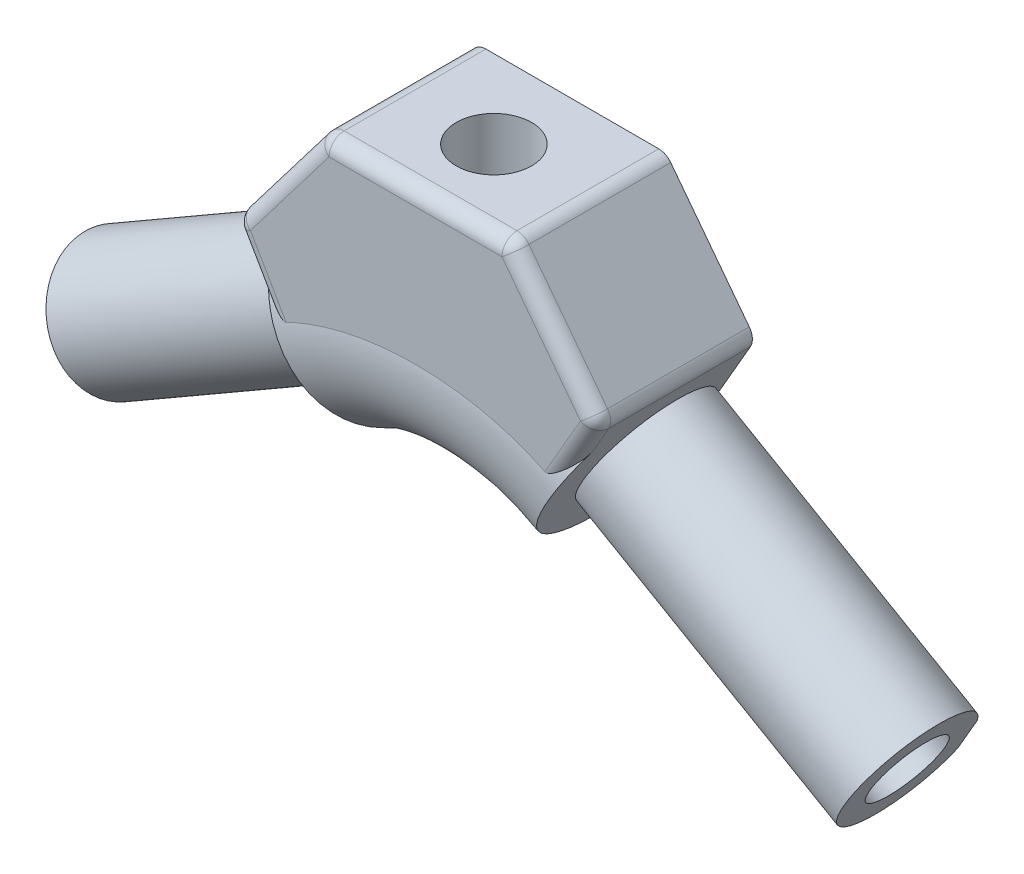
SolidWorks part; units mm, degrees
ref_plane "Płaszczyzna przednia" through (0, 0, 0) normal (0, 0, 1) x (1, 0, 0)
ref_plane "Płaszczyzna górna" through (0, 0, 0) normal (0, 1, 0) x (1, 0, 0)
ref_plane "Płaszczyzna prawa" through (0, 0, 0) normal (1, 0, 0) x (0, 0, -1)
sketch3d "Szkic 3D1"
  circle A2 centre (23.4458, 29.3718, 70.0368) radius 2.25
  circle A3 centre (14.5542, 29.3718, 70.0368) radius 2.25
  point P7 (25.3944, 28.2468, 70.0368)
  point P9 (12.6056, 28.2468, 70.0368)
ref_plane "Płaszczyzna1" through (4.866, -2.8094, 0) normal (0.866, -0.5, 0) x (0, 0, -1)
ref_plane "Płaszczyzna2" through (23.634, 13.6451, 0) normal (-0.866, -0.5, 0) x (0, 0, 1)
sketch "Szkic2" plane through (4.866, -2.8094, 0) normal (0.866, -0.5, 0) x (0, 0, -1)
  circle A0 centre (-70.0368, 37.1596) radius 2.1
  dimension "D1" = 4.2
extrude "Dodanie-wyciągnięcie1" add sketch "Szkic2" along normal blind 10
sketch "Szkic3" plane through (23.634, 13.6451, 0) normal (-0.866, -0.5, 0) x (0, 0, 1)
  circle A0 centre (70.0368, 18.1596) radius 2.1
  dimension "D1" = 4.2
extrude "Dodanie-wyciągnięcie2" add sketch "Szkic3" along normal blind 10 separate body
sketch "Szkic4" plane through (4.866, -2.8094, 0) normal (0.866, -0.5, 0) x (0, 0, -1)
  circle A0 centre (-70.0368, 37.1596) radius 3.25
  dimension "D1" = 6.5
sketch "Szkic5" plane through (23.634, 13.6451, 0) normal (-0.866, -0.5, 0) x (0, 0, 1)
  circle A0 centre (70.0368, 18.1596) radius 3.25
  dimension "D1" = 6.5
loft "Wyciągnięcie po profilach1" add profiles "Szkic5", "Szkic4"
hole_wizard "Otwór gwintowany M31" positions "Szkic6" profile "Szkic7" tap size "M3" standard "DIN"
sketch "Szkic6" plane through (14.9737, 8.6451, 0) normal (-0.866, -0.5, 0) x (0, 0, 1)
  point P0 (70.0368, 18.1596)
sketch "Szkic7" plane through (5.8939, 24.3718, 70.0368) normal (0, 0, 1) x (0.5, -0.866, 0)
  line L0 (0, 0) -> (0, 12)
  line L1 (0, 12) -> (1.25, 11.2489)
  line L2 (1.25, 11.2489) -> (1.25, 0)
  line L5 (1.25, 0) -> (0, 0)
  line L10 (0, 12) -> (-1.25, 11.2489) construction
  line L11 (0, -6.35) -> (0, 107.95) construction
  dimension "Średnica wiertła gwintu" = 2.5
  dimension "Głębokość otworu gwintowanego" = 12
  dimension "Kąt wiertła" = 118
hole_wizard "Otwór gwintowany M32" positions "Szkic8" profile "Szkic9" tap size "M3" standard "DIN"
sketch "Szkic8" plane through (13.5263, -7.8094, 0) normal (0.866, -0.5, 0) x (0, 0, -1)
  point P0 (-70.0368, 37.1596)
sketch "Szkic9" plane through (32.1061, 24.3718, 70.0368) normal (0, 0, 1) x (0.5, 0.866, 0)
  line L0 (0, 0) -> (0, 12)
  line L1 (0, 12) -> (1.25, 11.2489)
  line L2 (1.25, 11.2489) -> (1.25, 0)
  line L5 (1.25, 0) -> (0, 0)
  line L10 (0, 12) -> (-1.25, 11.2489) construction
  line L11 (0, -6.35) -> (0, 107.95) construction
  dimension "Średnica wiertła gwintu" = 2.5
  dimension "Głębokość otworu gwintowanego" = 12
  dimension "Kąt wiertła" = 118
sketch "Szkic10" plane through (4.866, -2.8094, 0) normal (0.866, -0.5, 0) x (0, 0, -1)
  line L1 (-59.4252, 44.0746) -> (-68.0368, 44.0746)
  line L2 (-59.4252, 44.0746) -> (-59.4252, 20.613)
  line L3 (-59.4252, 20.613) -> (-68.0368, 20.613)
  line L4 (-68.0368, 44.0746) -> (-68.0368, 20.613)
  circle A2 centre (-70.0368, 37.1596) radius 2.1 construction
  dimension "D1" = 0.1
extrude "Wytnij-wyciągnięcie1" cut sketch "Szkic10" against normal through all both and the other way through all
sketch "Szkic11" plane through (0, 0, 68.0368) normal (0, 0, -1) x (-1, 0, 0)
  line L1 (-22.1132, 36.0637) -> (-15.8868, 36.0637)
sketch "Szkic12" plane through (0, 0, 68.0368) normal (0, 0, -1) x (-1, 0, 0)
  line L0 (-22.1132, 36.0637) -> (-25.0709, 32.1864)
  line L1 (-25.0709, 32.1864) -> (-24.7267, 31.5902)
  line L2 (-22.1132, 36.0637) -> (-15.8868, 36.0637)
  line L3 (-15.8868, 36.0637) -> (-12.9291, 32.1865)
  line L4 (-12.9291, 32.1865) -> (-13.2734, 31.5902)
  spline S0 degree 3 poles (-962.2729, -2813.1692) (-5.856, -159.0771) (21.6742, 23.5832) (-17.0001, 32.9046) (-17.999, 33.017) (-19.991, 33.0172) (-20.9879, 32.9054) (-22.4418, 32.5564) (-22.9196, 32.4094) (-55.79, 19.6883) (-22.9038, -151.0074) (1024.058, -2777.9621) knots -9.492973 -9.492973 -9.492973 -9.492973 0.25 0.25 0.5 0.5 0.75 0.75 0.875 0.875 9.635108 9.635108 9.635108 9.635108 only from (-13.2734, 31.5902) to (-24.7267, 31.5902) construction
  spline S1 degree 3 poles (-13.2734, 31.5902) (-14.1404, 32.0908) (-15.065, 32.4382) (-17.0001, 32.9046) (-17.999, 33.017) (-19.991, 33.0172) (-20.9879, 32.9054) (-22.4418, 32.5564) (-22.9196, 32.4094) (-23.8444, 32.0515) (-24.2936, 31.8403) (-24.7267, 31.5902) knots 0 0 0 0 0.25 0.25 0.5 0.5 0.75 0.75 0.875 0.875 1 1 1 1
extrude "Dodanie-wyciągnięcie3" add sketch "Szkic12" against normal blind 5.2
sketch "Szkic13" plane through (0, 0, 73.2368) normal (0, 0, 1) x (1, 0, 0)
  line L0 (13.5042, 31.1904) -> (15.6042, 27.5531) construction
  line L1 (22.3958, 27.5531) -> (24.4958, 31.1904) construction
  line L2 (13.2734, 31.5902) -> (14.5542, 29.3718)
  line L3 (23.4458, 29.3718) -> (24.7267, 31.5902)
  line L4 (19, 30.4554) -> (19, 33.0171) construction
  arc A0 (14.5542, 29.3718) -> (23.4458, 29.3718) centre (19, 20.7938) cw
  spline S0 degree 3 poles (-655.4537, -1848.5356) (30.5463, -108.092) (51.4464, 21.3693) (22.9196, 32.4094) (22.4418, 32.5564) (20.9879, 32.9054) (19.991, 33.0172) (17.999, 33.017) (17.0001, 32.9046) (-16.6088, 24.8041) (-0.3634, -113.1332) (625.0206, -1871.7683) knots -7.460999 -7.460999 -7.460999 -7.460999 0.125 0.125 0.25 0.25 0.5 0.5 0.75 0.75 9.184126 9.184126 9.184126 9.184126 only from (24.7267, 31.5902) to (13.2734, 31.5902) construction
  spline S1 degree 3 poles (24.7267, 31.5902) (24.2936, 31.8403) (23.8444, 32.0515) (22.9196, 32.4094) (22.4418, 32.5564) (20.9879, 32.9054) (19.991, 33.0172) (17.999, 33.017) (17.0001, 32.9046) (15.065, 32.4382) (14.1404, 32.0908) (13.2734, 31.5902) knots 0 0 0 0 0.125 0.125 0.25 0.25 0.5 0.5 0.75 0.75 1 1 1 1
  dimension "D1" = 9.6616
extrude "Dodanie-wyciągnięcie4" add sketch "Szkic13" against normal blind 1.3
sketch "Szkic14" plane through (0, 36.0637, 0) normal (0, 1, 0) x (1, 0, 0)
  line L0 (15.8868, -68.0368) -> (22.1132, -73.2368)
  point P4 (19, -70.6368)
hole_wizard "Otwór gwintowany M33" positions "Szkic15" profile "Szkic16" tap size "M3" standard "DIN"
sketch "Szkic15" plane through (0, 36.0637, 0) normal (0, 1, 0) x (1, 0, 0)
  point P0 (19, -70.6368)
sketch "Szkic16" plane through (19, 36.0637, 70.6368) normal (1, 0, 0) x (0, 0, 1)
  line L0 (0, 0) -> (0, 12)
  line L1 (0, 12) -> (1.25, 11.2489)
  line L2 (1.25, 11.2489) -> (1.25, 0)
  line L5 (1.25, 0) -> (0, 0)
  line L10 (0, 12) -> (-1.25, 11.2489) construction
  line L11 (0, -6.35) -> (0, 107.95) construction
  dimension "Średnica wiertła gwintu" = 2.5
  dimension "Głębokość otworu gwintowanego" = 12
  dimension "Kąt wiertła" = 118
fillet "Zaokrąglenie1" radius 0.5 4 edges at (22.1132, 36.0637, 70.6368) (15.8868, 36.0637, 70.6368)
fillet "Zaokrąglenie2" radius 0.5 9 edges at (13.0296, 32.1801, 73.2368) (14.4339, 34.1591, 73.2368) (15.9124, 36.0118, 73.2368) (19, 36.0637, 73.2368) (22.0876, 36.0118, 73.2368) (24.9703, 32.1799, 73.2368) (23.5661, 34.1591, 73.2368)
